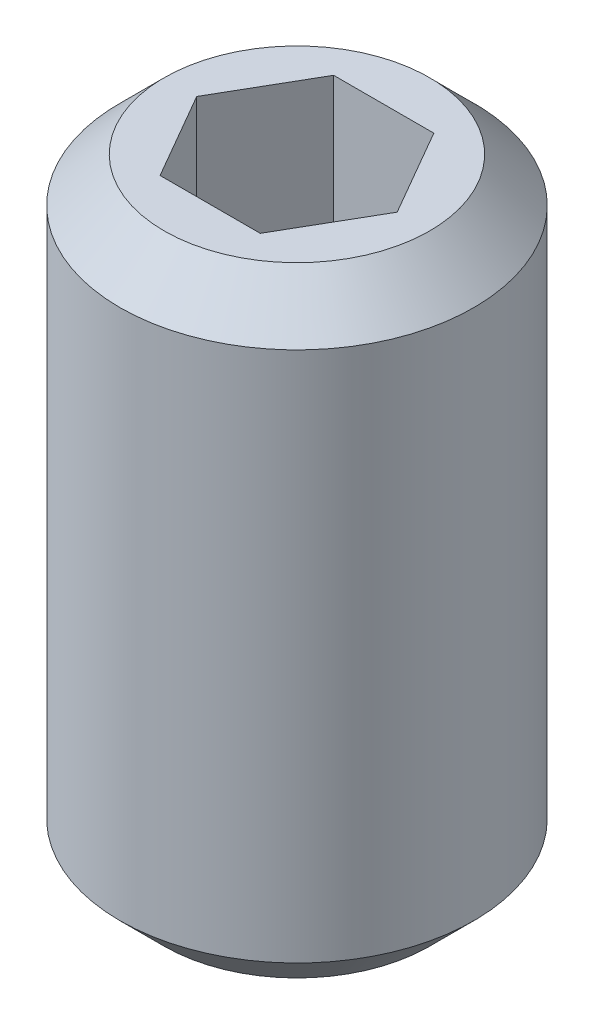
SolidWorks part; units mm, degrees
ref_plane "Plan1" through (0, 0, 0) normal (0, 0, 1) x (1, 0, 0)
ref_plane "Plan2" through (0, 0, 0) normal (0, 1, 0) x (1, 0, 0)
ref_plane "Plan3" through (0, 0, 0) normal (1, 0, 0) x (0, 0, -1)
sketch "Esquisse1" plane through (0, 0, 0) normal (0, 1, 0) x (1, 0, 0)
  circle A0 centre (0, 0) radius 2
  dimension "D1" = 4
extrude "Base-Extrusion" add sketch "Esquisse1" along normal blind 7
sketch "Esquisse2" plane through (0, 7, 0) normal (0, 1, 0) x (-1, 0, 0)
  line L0 (-1.8121, 0) -> (2, 0) construction
  line L1 (0, -1.6384) -> (0, 2) construction
  line L8 (0.5, 0.866) -> (-0.5662, -0.9806) construction
  line L9 (0.5, -0.866) -> (-0.5662, 0.9806) construction
  line L10 (0, 0) -> (0.5662, 0.9806) construction
  line L11 (0, 0) -> (0.5662, -0.9806) construction
  line L12 (-1.1323, 0) -> (-0.5662, 0.9806)
  line L13 (-0.5662, 0.9806) -> (0.5662, 0.9806)
  line L14 (0.5662, 0.9806) -> (1.1323, 0)
  line L15 (1.1323, 0) -> (0.5662, -0.9806)
  line L16 (0.5662, -0.9806) -> (-0.5662, -0.9806)
  line L17 (-0.5662, -0.9806) -> (-1.1323, 0)
  circle A1 centre (0, 0) radius 2 construction
  point P8 (-1, 0)
  point P12 (-0.5, 0.866)
  point P13 (0.5, 0.866)
  point P14 (1, 0)
  point P15 (0.5, -0.866)
  point P16 (-0.5, -0.866)
extrude "Enlèv. mat.-Extru.1" cut sketch "Esquisse2" against normal blind 3
chamfer "Chanfrein1" distance 0.5 angle 45
chamfer "Chanfrein2" distance 0.5 angle 45
